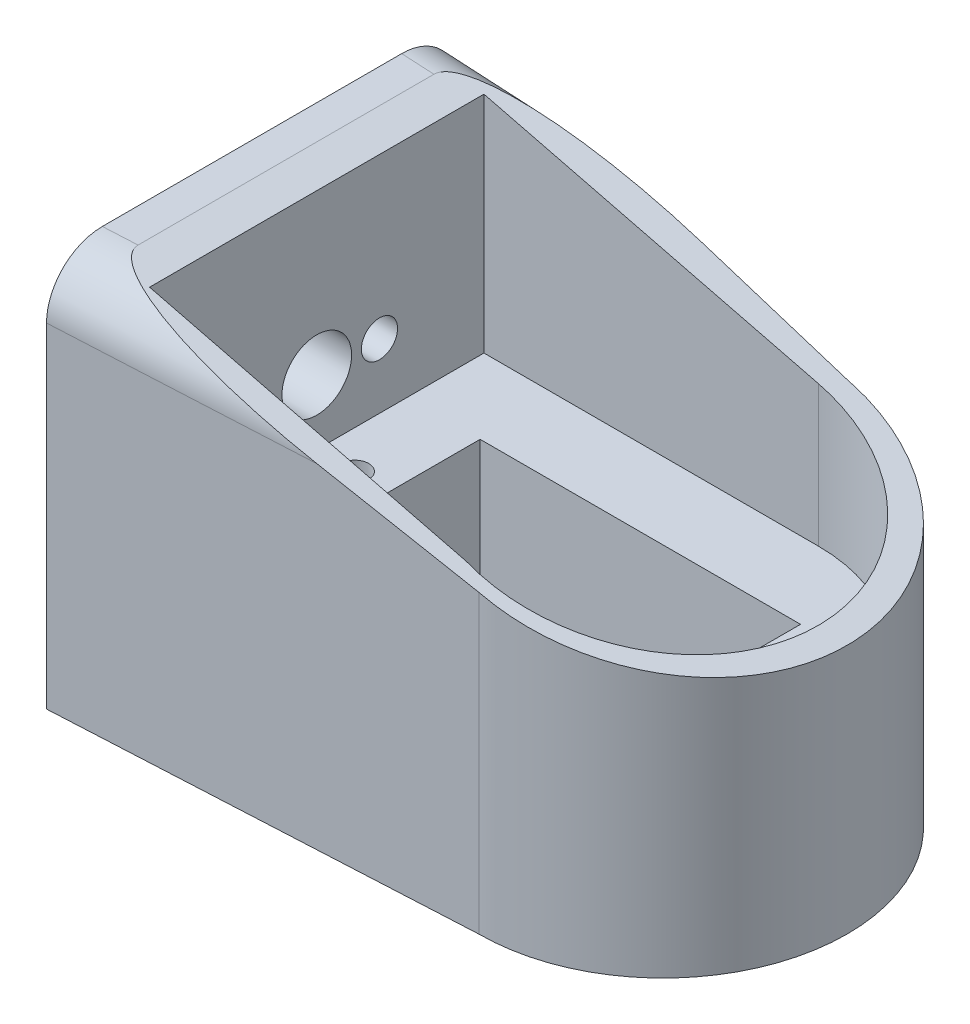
SolidWorks part; units mm, degrees
ref_plane "Front Plane" through (0, 0, 0) normal (0, 0, 1) x (1, 0, 0)
ref_plane "Top Plane" through (0, 0, 0) normal (0, 1, 0) x (1, 0, 0)
ref_plane "Right Plane" through (0, 0, 0) normal (1, 0, 0) x (0, 0, -1)
sketch "Sketch1" plane through (0, 0, 0) normal (0, 0, 1) x (1, 0, 0)
  line L1 (-0.9307, 0) -> (28.5693, 0)
  line L2 (-0.9307, 0) -> (-0.9307, 28)
  line L3 (-0.9307, 28) -> (28.5693, 28)
  line L4 (28.5693, 0) -> (28.5693, 28)
  dimension "D1" = 28
  dimension "D2" = 29.5
extrude "Boss-Extrude2" add sketch "Sketch1" along normal blind 29.5
sketch "Sketch5" plane through (0, 0, 0) normal (0, -1, 0) x (1, 0, 0)
  line L1 (-0.9307, 29.5) -> (28.5693, 27.97)
  line L2 (28.5693, 27.97) -> (28.5693, 29.5)
  line L3 (28.5693, 29.5) -> (-0.9307, 29.5)
  line L4 (28.5693, 1.53) -> (-0.9307, 0)
  line L5 (-0.9307, 0) -> (28.5693, 0)
  line L6 (28.5693, 0) -> (28.5693, 1.53)
extrude "Cut-Extrude3" cut sketch "Sketch5" against normal blind 29.5
sketch "Sketch6" plane through (0, 0, 0) normal (0, -1, 0) x (1, 0, 0)
  line L0 (28.5693, 27.97) -> (28.5693, 1.53) construction
  line L1 (28.5693, 27.97) -> (28.5693, 1.53)
  arc A0 (28.5693, 1.53) -> (28.5693, 27.97) centre (28.5693, 14.75) ccw
extrude "Boss-Extrude4" add sketch "Sketch6" against normal up to surface (28 mm away)
sketch "Sketch7" plane through (0, 28, 0) normal (0, 1, 0) x (1, 0, 0)
  line L0 (3.9346, -2.9678) -> (3.9346, -26.9678)
  line L1 (3.9346, -2.9678) -> (27.9346, -2.9678)
  line L2 (3.9346, -26.9678) -> (26.6396, -26.9678)
  arc A0 (27.9346, -2.9678) -> (26.6396, -26.9678) centre (27.9346, -15.0027) cw
  dimension "D1" = 24
  dimension "D2" = 24
extrude "Cut-Extrude4" cut sketch "Sketch7" against normal blind 16.7
sketch "Sketch8" plane through (0, 11.3, 0) normal (0, 1, 0) x (1, 0, 0)
  line L0 (-960.0304, -14.9678) -> (49039.9696, -14.9678) construction
  line L1 (9.1594, -8.4678) -> (32.1594, -8.4678)
  line L2 (9.1594, -8.4678) -> (9.1594, -21.4678)
  line L3 (9.1594, -21.4678) -> (32.1594, -21.4678)
  line L4 (32.1594, -8.4678) -> (32.1594, -21.4678)
  line L5 (9.1594, -8.4678) -> (32.1594, -21.4678) construction
  line L6 (9.1594, -21.4678) -> (32.1594, -8.4678) construction
  line L9 (27.9346, -2.9678) -> (3.9346, -2.9678) construction
  point P0 (20.6594, -14.9678)
  point P5 (22.9612, -14.2206)
  point P7 (21.0738, -14.9678)
  point P9 (20.6594, -14.9678)
  dimension "D1" = 23
  dimension "D2" = 13
  dimension "D3" = 12
extrude "Cut-Extrude5" cut sketch "Sketch8" against normal blind 9
sketch "Sketch9" plane through (0, 11.3, 0) normal (0, 1, 0) x (1, 0, 0)
  line L0 (32.1594, -21.4678) -> (32.1594, -8.4678) construction
  line L1 (9.1594, -8.4678) -> (9.1594, -21.4678) construction
  line L2 (-996.0654, -14.9678) -> (49003.9346, -14.9678) construction
  line L3 (3.9346, -2.9678) -> (3.9346, -26.9678) construction
  circle A0 centre (6.6594, -14.9678) radius 1
  circle A1 centre (34.6594, -14.9678) radius 1
  point P13 (3.9346, -14.9678)
  dimension "D1" = 2
  dimension "D2" = 2
  dimension "D3" = 2.5
  dimension "D4" = 2.5
extrude "Cut-Extrude6" cut sketch "Sketch9" against normal blind 5
sketch "Sketch10" plane through (0, 2.3, 0) normal (0, 1, 0) x (1, 0, 0)
  line L0 (32.1594, -8.4678) -> (9.1594, -8.4678) construction
  line L1 (32.1594, -21.4678) -> (32.1594, -8.4678) construction
  circle A0 centre (25.1594, -14.9678) radius 6.5
  dimension "D1" = 13
  dimension "D2" = 6.5
  dimension "D3" = 7
extrude "Cut-Extrude7" cut sketch "Sketch10" against normal blind 5
sketch "Sketch11" plane through (3.9346, 0, 0) normal (1, 0, 0) x (0, 0, -1)
  line L0 (-26.9678, 11.3) -> (-26.9678, 28) construction
  circle A0 centre (-14.9678, 15.9366) radius 2.5
  circle A1 centre (-10.4678, 15.9366) radius 1.3
  circle A2 centre (-19.4678, 15.9366) radius 1.3
  dimension "D1" = 2.6
  dimension "D2" = 5
  dimension "D3" = 2.6
  dimension "D4" = 4.5
  dimension "D5" = 4.5
  dimension "D6" = 12
extrude "Cut-Extrude8" cut sketch "Sketch11" against normal blind 5
sketch "Sketch13" plane through (0, 0, 0) normal (0, 0, 1) x (1, 0, 0)
  line L0 (1.5085, 28) -> (44.414, 17.2916)
  line L1 (-0.9307, 28) -> (28.5693, 28) construction
  line L2 (44.414, 17.2916) -> (44.8283, 29.5832)
  arc A0 (44.8283, 29.5832) -> (1.5085, 28) centre (34.422, -279.1374) ccw
extrude "Cut-Extrude9" cut sketch "Sketch13" along normal blind 42
fillet "Fillet1" radius 4 2 edges at (0.2889, 28, 0.0633) (0.2889, 28, 29.4367)
